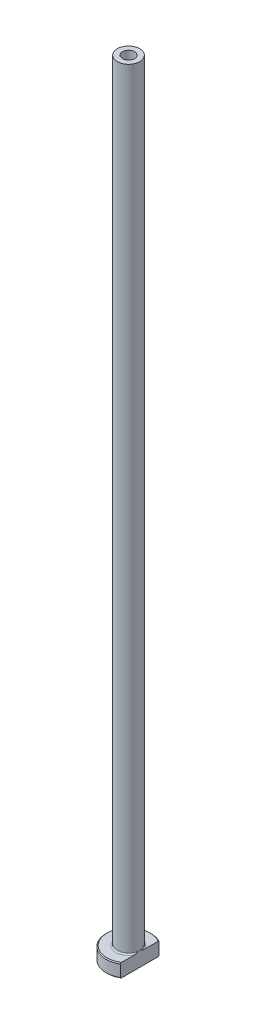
SolidWorks part; units mm, degrees
ref_plane "Front Plane" through (0, 0, 0) normal (0, 0, 1) x (1, 0, 0)
ref_plane "Top Plane" through (0, 0, 0) normal (0, 1, 0) x (1, 0, 0)
ref_plane "Right Plane" through (0, 0, 0) normal (1, 0, 0) x (0, 0, -1)
sketch "Sketch1" plane through (0, 0, 0) normal (0, 0, 1) x (1, 0, 0)
  line L0 (-1.35, 175) -> (-2.5, 175)
  line L1 (-2.5, 175) -> (-2.5, 3)
  line L2 (-2.5, 3) -> (-5, 3)
  line L3 (-5, 3) -> (-5, 0)
  line L4 (4.125, 0) -> (-4.125, 0) construction
  line L5 (-5, 0) -> (-1.6, 0)
  line L6 (-1.35, 130) -> (-1.35, 175)
  line L7 (0, 92.1877) -> (0, -15.5353) construction
  line L8 (0, -5.5) -> (0, 5.5) construction
  line L9 (-1.35, 130) -> (-1.6, 118)
  line L10 (-1.6, 118) -> (-1.6, 0)
  dimension "D1" = 0.25
  dimension "ID" = 2.7
  dimension "OD" = 5
  dimension "L" = 175
  dimension "H" = 10
  dimension "T" = 3
  dimension "N" = 45
  dimension "D2" = 12
  dimension "L-N" = 130
revolve "Revolve1" add sketch "Sketch1" angle 360 about L7
fillet "Fillet1" radius 0.3 1 edges at (0, 3, 2.5)
chamfer "Chamfer1" distance 0.2 angle 45 2 edges at (0, 3, 5) (0, 0, 5)
sketch "Sketch2" plane through (0, 0, 0) normal (0, -1, 0) x (1, 0, 0)
  line L0 (2.5, 4.3301) -> (2.5, -4.3301)
  circle A0 centre (0, 0) radius 5 construction
  arc A1 (2.5, 4.3301) -> (2.5, -4.3301) centre (0, 0) cw
  circle A2 centre (0, 0) radius 2.5 construction
extrude "Cut-Extrude1" cut sketch "Sketch2" against normal through all
chamfer "Chamfer2" distance 0.5 angle 45 1 edges at (0, 0, 1.6)
